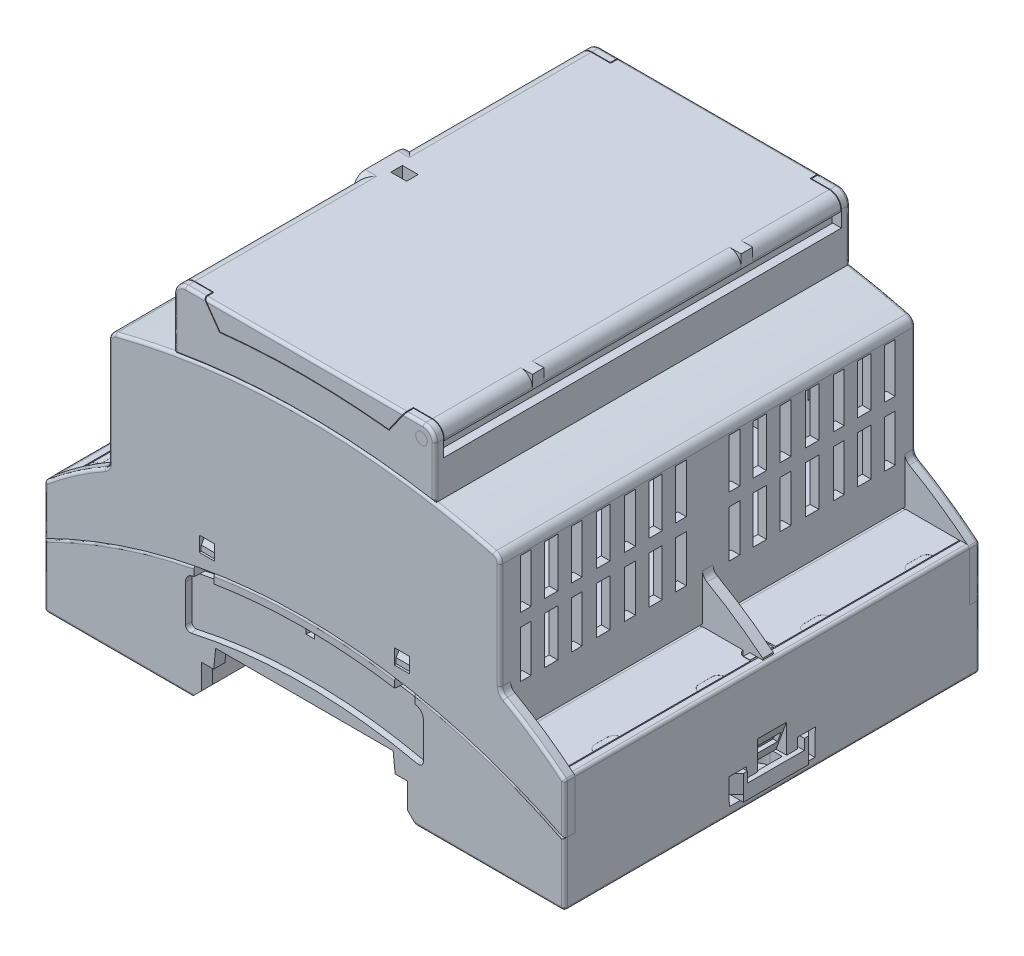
SolidWorks part; units mm, degrees
ref_plane "Front" through (0, 0, 0) normal (0, 0, 1) x (1, 0, 0)
ref_plane "Top" through (0, 0, 0) normal (0, 1, 0) x (1, 0, 0)
ref_plane "Right" through (0, 0, 0) normal (1, 0, 0) x (0, 0, -1)
imported_body "pxc_2896267_03_BC-71-6-UT-HBUS-BK_3D.stp-1/BC_71.6_GEH-UT_HBUS_H.Select__00377778.stp-1-solid1"
imported_body "pxc_2896267_03_BC-71-6-UT-HBUS-BK_3D.stp-1/Fussriegel_14.4_L30_Sperr_H.Select__00370451.stp-1-solid1"
imported_body "pxc_2896267_03_BC-71-6-UT-HBUS-BK_3D.stp-1/Fussriegel_14.4_L30_Sperr_H.Select__00370451.stp-2-solid1"
imported_body "输入1"
imported_body "输入2"
imported_body "输入3"
imported_body "输入4"
move or copy body "实体-移动/复制1" bodies to move or copy 107 copy no translate (0, 0, 35.9)
